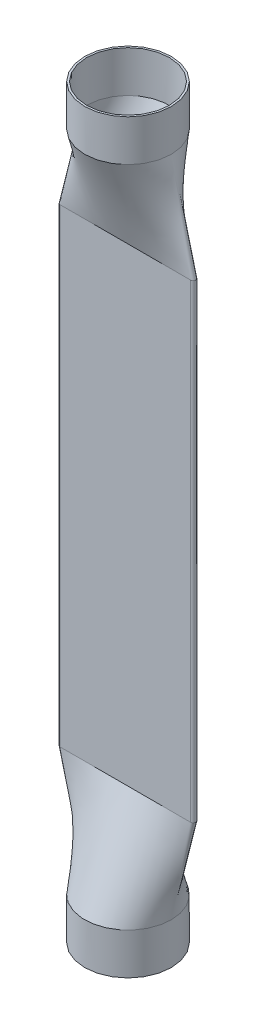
SolidWorks part; units mm, degrees
ref_plane "Front Plane" through (0, 0, 0) normal (0, 0, 1) x (1, 0, 0)
ref_plane "Top Plane" through (0, 0, 0) normal (0, 1, 0) x (1, 0, 0)
ref_plane "Right Plane" through (0, 0, 0) normal (1, 0, 0) x (0, 0, -1)
sketch "Sketch1" plane through (0, 0, 0) normal (0, 1, 0) x (1, 0, 0)
  circle A0 centre (0, 0) radius 38.1
  circle A1 centre (0, 0) radius 39.9034
  dimension "D1" = 1.8034
  dimension "D2" = 76.2
extrude "Boss-Extrude1" add sketch "Sketch1" along normal blind 38.1
sketch "Sketch2" plane through (0, 38.1, 0) normal (0, 1, 0) x (1, 0, 0)
  circle A0 centre (0, 0) radius 39.9034
  circle A2 centre (0, 0) radius 39.9034 construction
  point P2 (0, -39.9034)
ref_plane "Plane1" through (0, 127, 0) normal (0, 1, 0) x (1, 0, 0)
sketch "Sketch3" plane through (0, 127, 0) normal (0, 1, 0) x (1, 0, 0)
  line L0 (59.871, 0) -> (-59.871, 0) construction
  line L1 (59.871, -2.4384) -> (-59.871, -2.4384)
  line L2 (59.871, 2.4384) -> (-59.871, 2.4384)
  arc A0 (59.871, -2.4384) -> (59.871, 2.4384) centre (59.871, 0) ccw
  arc A3 (-59.871, 2.4384) -> (-59.871, -2.4384) centre (-59.871, 0) ccw
  point P2 (0, 0)
  dimension "D2" = 124.6188
  dimension "D1" = 4.8768
loft "Loft5" add profiles "Sketch2", "Sketch3"
sketch "Sketch6" plane through (0, 127, 0) normal (0, 1, 0) x (1, 0, 0)
  line L4 (-59.871, -0.635) -> (59.871, -0.635)
  line L5 (59.871, 0.635) -> (-59.871, 0.635)
  line L6 (-59.871, -0.635) -> (59.871, -0.635)
  line L7 (59.871, 0.635) -> (-59.871, 0.635)
  arc A4 (-59.871, 0.635) -> (-59.871, -0.635) centre (-59.871, 0) ccw
  arc A5 (59.871, -0.635) -> (59.871, 0.635) centre (59.871, 0) ccw
  arc A6 (-59.871, 0.635) -> (-59.871, -0.635) centre (-59.871, 0) ccw
  arc A7 (59.871, -0.635) -> (59.871, 0.635) centre (59.871, 0) ccw
  dimension "D1" = 1.8034
ref_plane "Plane3" through (0, 38.1, 0) normal (0, 1, 0) x (1, 0, 0)
sketch "Sketch7" plane through (0, 38.1, 0) normal (0, 1, 0) x (1, 0, 0)
  circle A0 centre (0, 0) radius 38.1
  circle A1 centre (0, 0) radius 38.1 construction
loft "Cut-Loft1" cut profiles "Sketch7", "Sketch6"
sketch "Sketch8" plane through (0, 127, 0) normal (0, 1, 0) x (1, 0, 0)
  line L4 (59.871, 2.4384) -> (-59.871, 2.4384)
  line L5 (-59.871, -2.4384) -> (59.871, -2.4384)
  line L6 (59.871, 2.4384) -> (-59.871, 2.4384)
  line L7 (-59.871, -2.4384) -> (59.871, -2.4384)
  line L15 (-59.871, -0.635) -> (59.871, -0.635)
  line L16 (59.871, 0.635) -> (-59.871, 0.635)
  line L17 (-59.871, -0.635) -> (59.871, -0.635)
  line L18 (59.871, 0.635) -> (-59.871, 0.635)
  arc A6 (-59.871, 0.635) -> (-59.871, -0.635) centre (-59.871, 0) ccw
  arc A7 (59.871, -0.635) -> (59.871, 0.635) centre (59.871, 0) ccw
  arc A8 (-59.871, 0.635) -> (-59.871, -0.635) centre (-59.871, 0) ccw
  arc A9 (59.871, -0.635) -> (59.871, 0.635) centre (59.871, 0) ccw
  spline S2 degree 3 poles (2576.9183, -4320.8722) (68.2373, 198.2523) (43.4204, -10.7537) (61.3899, -1.9862) (62.1011, -1.1909) (62.415, 0) (62.1011, 1.1909) (61.3899, 1.9862) (43.4203, 10.7537) (68.2374, -198.2534) (2576.9387, 4320.9089) knots 0.304758 0.304758 0.304758 0.304758 0.481178 0.483867 0.486556 0.489245 0.491934 0.494622 0.497311 0.673732 0.673732 0.673732 0.673732 only from (59.871, -2.4384) to (59.871, 2.4384)
  spline S3 degree 3 poles (59.871, -2.4384) (60.0993, -2.4384) (60.5926, -2.3753) (61.3899, -1.9862) (62.1011, -1.1909) (62.415, 0) (62.1011, 1.1909) (61.3899, 1.9862) (60.5926, 2.3753) (60.0993, 2.4384) (59.871, 2.4384) knots 0.47849 0.47849 0.47849 0.47849 0.481178 0.483867 0.486556 0.489245 0.491934 0.494622 0.497311 0.5 0.5 0.5 0.5
  spline S4 degree 3 poles (-2576.9183, 4320.8722) (-68.2373, -198.2523) (-43.4204, 10.7537) (-61.3899, 1.9862) (-62.1011, 1.1909) (-62.415, 0) (-62.1011, -1.1909) (-61.3899, -1.9862) (-43.4203, -10.7537) (-68.2374, 198.2534) (-2576.9388, -4320.9089) knots 0.804758 0.804758 0.804758 0.804758 0.981178 0.983867 0.986556 0.989245 0.991934 0.994622 0.997311 1.173732 1.173732 1.173732 1.173732 only from (-59.871, 2.4384) to (-59.871, -2.4384)
  spline S5 degree 3 poles (-59.871, 2.4384) (-60.0993, 2.4384) (-60.5926, 2.3753) (-61.3899, 1.9862) (-62.1011, 1.1909) (-62.415, 0) (-62.1011, -1.1909) (-61.3899, -1.9862) (-60.5926, -2.3753) (-60.0993, -2.4384) (-59.871, -2.4384) knots 0.97849 0.97849 0.97849 0.97849 0.981178 0.983867 0.986556 0.989245 0.991934 0.994622 0.997311 1 1 1 1
  dimension "D1" = 0
  dimension "D2" = 0
extrude "Boss-Extrude2" add sketch "Sketch8" along normal offset from surface (266.7 mm away) 393.7
ref_plane "Plane4" through (0, 393.7, 0) normal (0, 1, 0) x (1, 0, 0)
mirror "Mirror6" about plane through (0, 393.7, 0) normal (0, 1, 0) of "Boss-Extrude2"
mirror "Mirror7" about plane through (0, 393.7, 0) normal (0, 1, 0) of "Loft5", "Cut-Loft1"
mirror "Mirror8" about plane through (0, 393.7, 0) normal (0, 1, 0) of "Boss-Extrude1"
